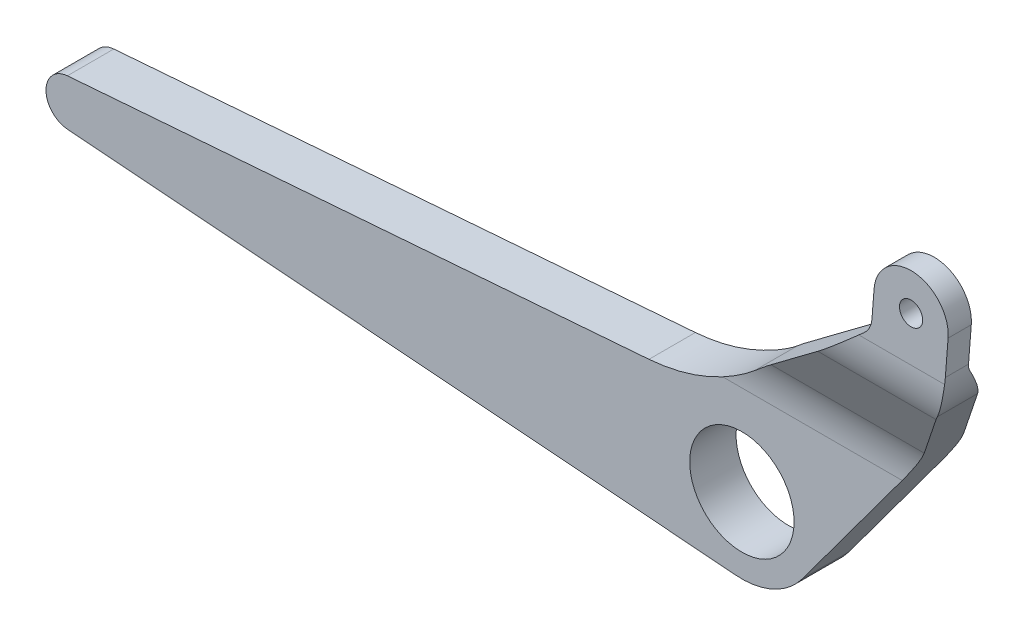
SolidWorks part; units mm, degrees
other "<Drive_Stinger>-<Fillet23>"
ref_plane "Front Plane" through (0, 0, 0) normal (0, 0, 1) x (1, 0, 0)
ref_plane "Top Plane" through (0, 0, 0) normal (0, 1, 0) x (1, 0, 0)
ref_plane "Right Plane" through (0, 0, 0) normal (1, 0, 0) x (0, 0, -1)
mirrored part "Drive_Stinger_Mirrored"
